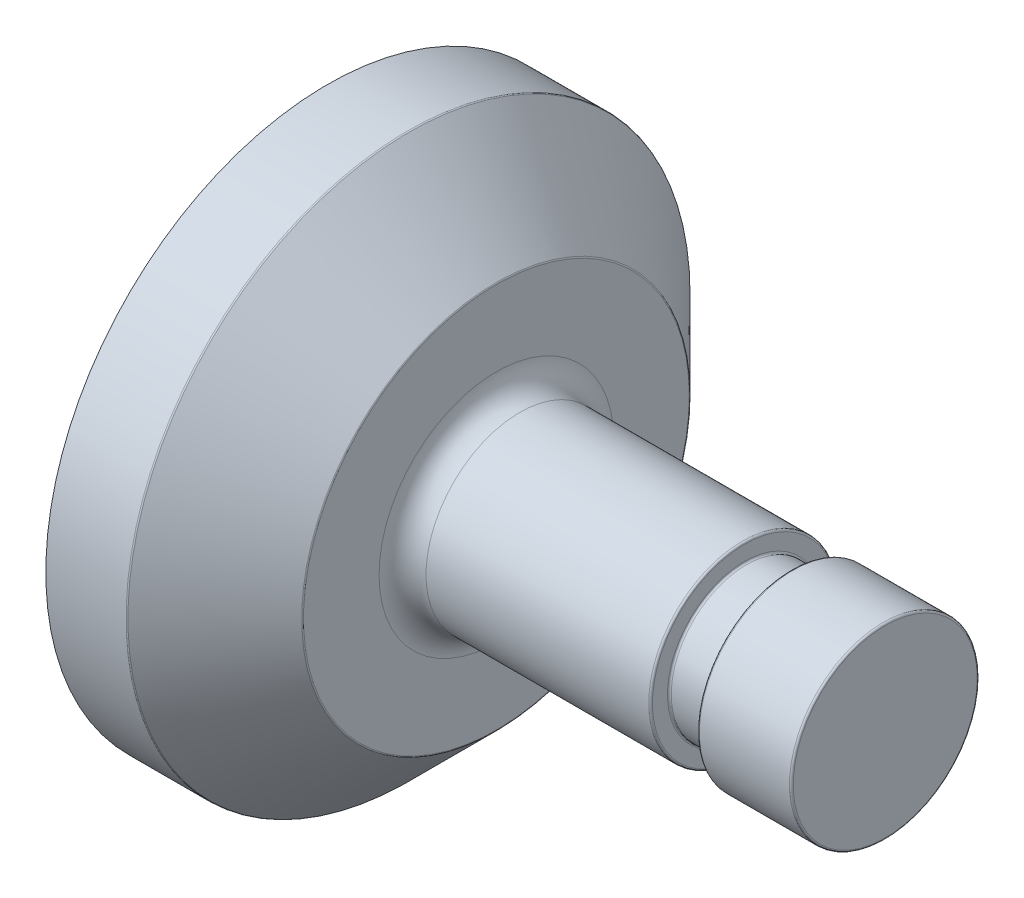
SolidWorks part; units mm, degrees
ref_plane "Front Plane" through (0, 0, 0) normal (0, 0, 1) x (1, 0, 0)
ref_plane "Top Plane" through (0, 0, 0) normal (0, 1, 0) x (1, 0, 0)
ref_plane "Right Plane" through (0, 0, 0) normal (1, 0, 0) x (0, 0, -1)
sketch "Sketch1" plane through (0, 0, 0) normal (0, 0, 1) x (1, 0, 0)
  line L0 (0, 0) -> (0, 12.446)
  line L1 (-0.254, 12.7) -> (-12.446, 12.7)
  line L2 (-12.7, 12.446) -> (-12.7, 10.414)
  line L3 (-12.954, 10.16) -> (-18.796, 10.16)
  line L4 (-19.05, 10.414) -> (-19.05, 12.446)
  line L5 (-19.304, 12.7) -> (-49.4328, 12.7)
  line L6 (-52.6078, 15.875) -> (-52.6078, 26.0958)
  line L7 (-52.6822, 26.2754) -> (-64.4324, 38.0256)
  line L8 (-64.612, 38.1) -> (-75.4707, 38.1)
  line L9 (-75.4707, 38.1) -> (-75.4707, 0)
  line L10 (0, 0) -> (-75.4707, 0)
  line L11 (4.5824, 0) -> (-100.9838, 0) construction
  arc A0 (0, 12.446) -> (-0.254, 12.7) centre (-0.254, 12.446) ccw
  arc A1 (-12.446, 12.7) -> (-12.7, 12.446) centre (-12.446, 12.446) ccw
  arc A2 (-12.7, 10.414) -> (-12.954, 10.16) centre (-12.954, 10.414) cw
  arc A3 (-18.796, 10.16) -> (-19.05, 10.414) centre (-18.796, 10.414) cw
  arc A4 (-19.05, 12.446) -> (-19.304, 12.7) centre (-19.304, 12.446) ccw
  arc A5 (-49.4328, 12.7) -> (-52.6078, 15.875) centre (-49.4328, 15.875) cw
  arc A6 (-52.6078, 26.0958) -> (-52.6822, 26.2754) centre (-52.8618, 26.0958) ccw
  arc A7 (-64.4324, 38.0256) -> (-64.612, 38.1) centre (-64.612, 37.846) ccw
  point P16 (0, 12.7)
  point P19 (-12.7, 12.7)
  point P22 (-12.7, 10.16)
  point P25 (-19.05, 10.16)
  dimension "D8" = 0.254
  dimension "D9" = 3.175
  dimension "D1" = 38.1
  dimension "D2" = 12.7
  dimension "D3" = 10.16
  dimension "D4" = 12.7
  dimension "D5" = 12.7
  dimension "D6" = 6.35
  dimension "D7" = 45
revolve "Revolve2" add sketch "Sketch1" angle 360 about L11
sketch "Stock" plane through (0, 0, 0) normal (0, 0, 1) x (1, 0, 0)
  line L0 (-12.446, 15.875) -> (-19.304, 15.875)
  line L11 (3.175, 0) -> (-78.6457, 0)
  line L12 (4.5824, 0) -> (-100.9838, 0) construction
  line L22 (-78.6457, -3.175) -> (3.175, -3.175)
  line L23 (-78.6457, 41.275) -> (-78.6457, -3.175)
  line L24 (-64.612, 41.275) -> (-78.6457, 41.275)
  line L25 (-50.4371, 28.5205) -> (-62.1873, 40.2707)
  line L26 (-49.4328, 15.875) -> (-49.4328, 26.0958)
  line L27 (-19.304, 15.875) -> (-49.4328, 15.875)
  line L28 (-0.254, 15.875) -> (-12.446, 15.875)
  line L29 (3.175, -3.175) -> (3.175, 12.446)
  line L31 (-78.6457, 41.275) -> (-78.6457, 0)
  line L32 (-64.612, 41.275) -> (-78.6457, 41.275)
  line L33 (-50.4371, 28.5205) -> (-62.1873, 40.2707)
  line L34 (-49.4328, 15.875) -> (-49.4328, 26.0958)
  line L35 (-19.304, 15.875) -> (-49.4328, 15.875)
  line L36 (-0.254, 15.875) -> (-12.446, 15.875)
  line L37 (3.175, 0) -> (3.175, 12.446)
  arc A16 (-62.1873, 40.2707) -> (-64.612, 41.275) centre (-64.612, 37.846) ccw
  arc A17 (-49.4328, 26.0958) -> (-50.4371, 28.5205) centre (-52.8618, 26.0958) ccw
  arc A18 (-15.875, 12.446) -> (-19.304, 15.875) centre (-19.304, 12.446) ccw
  arc A19 (-12.446, 15.875) -> (-15.875, 12.446) centre (-12.446, 12.446) ccw
  arc A20 (3.175, 12.446) -> (-0.254, 15.875) centre (-0.254, 12.446) ccw
  arc A21 (-62.1873, 40.2707) -> (-64.612, 41.275) centre (-64.612, 37.846) ccw
  arc A22 (-49.4328, 26.0958) -> (-50.4371, 28.5205) centre (-52.8618, 26.0958) ccw
  arc A25 (3.175, 12.446) -> (-0.254, 15.875) centre (-0.254, 12.446) ccw
  dimension "D1" = 3.175
